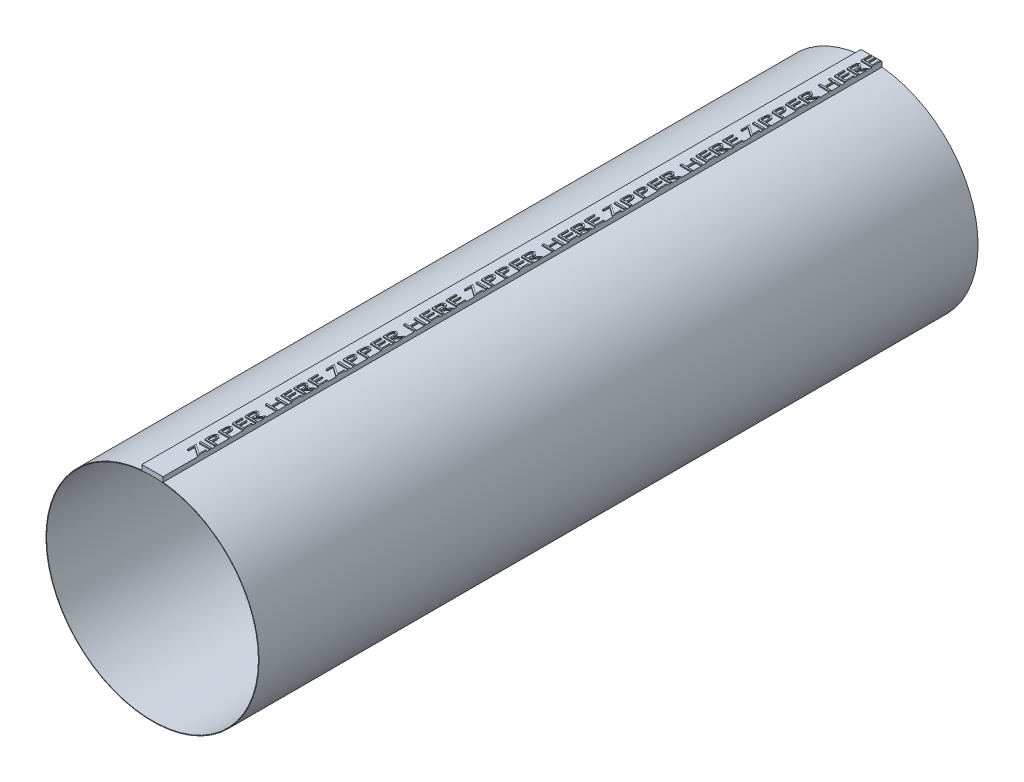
SolidWorks part; units mm, degrees
ref_plane "Front" through (0, 0, 0) normal (0, 0, 1) x (1, 0, 0)
ref_plane "Top" through (0, 0, 0) normal (0, 1, 0) x (1, 0, 0)
ref_plane "Right" through (0, 0, 0) normal (1, 0, 0) x (0, 0, -1)
sketch "Sketch1" plane through (0, 0, 0) normal (0, 0, 1) x (1, 0, 0)
  circle A0 centre (0, 0) radius 127
  circle A1 centre (0, 0) radius 127.635
  dimension "D1" = 254
  dimension "D2" = 255.27
extrude "Boss-Extrude1" add sketch "Sketch1" along normal blind 861.695
ref_plane "Plane1" through (0, 127.635, 0) normal (0, 1, 0) x (1, 0, 0)
sketch "Sketch2" plane through (0, 127.635, 0) normal (0, 1, 0) x (1, 0, 0)
  line L0 (127, 0) -> (-127, 0) construction
  line L1 (-12.7, 0) -> (12.7, 0)
  line L2 (-12.7, 0) -> (-12.7, -861.695)
  line L3 (-12.7, -861.695) -> (12.7, -861.695)
  line L4 (12.7, 0) -> (12.7, -861.695)
  line L5 (-127.635, -861.695) -> (127.635, -861.695) construction
  dimension "D1" = 12.7
  dimension "D2" = 25.4
extrude "Boss-Extrude3" add sketch "Sketch2" along normal blind 5.08 and the other way up to surface
sketch "Sketch4" plane through (0, 132.715, 0) normal (0, 1, 0) x (1, 0, 0)
  line L0 (12.7, 0) -> (12.7, -861.695) construction
  text T0 "      ZIPPER HERE ZIPPER HERE ZIPPER HERE ZIPPER HERE ZIPPER HERE" font "Century Gothic" height 12.7
extrude "Boss-Extrude4" add sketch "Sketch4" along normal blind 1.27
